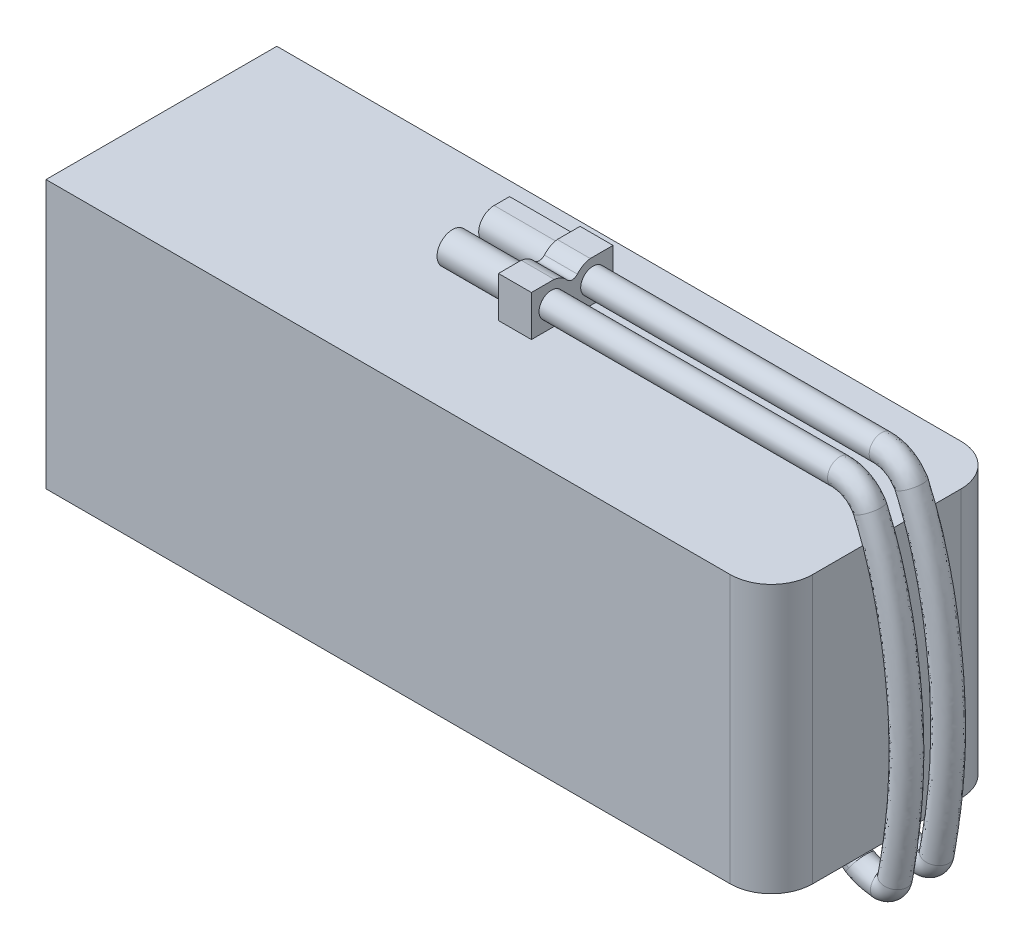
SolidWorks part; units mm, degrees
ref_plane "Front Plane" through (0, 0, 0) normal (0, 0, 1) x (1, 0, 0)
ref_plane "Top Plane" through (0, 0, 0) normal (0, 1, 0) x (1, 0, 0)
ref_plane "Right Plane" through (0, 0, 0) normal (1, 0, 0) x (0, 0, -1)
sketch "Sketch3" plane through (0, 0, 0) normal (0, 1, 0) x (1, 0, 0)
  line L0 (-88, 28) -> (-88, -28)
  line L1 (-88, -28) -> (88, -28)
  line L2 (0, 35.3062) -> (0, -46.0711) construction
  line L3 (88, -28) -> (88, 28)
  line L4 (88, 28) -> (-88, 28)
  line L5 (-17.8116, 0) -> (16.9118, 0) construction
  dimension "D2" = 176
  dimension "D3" = 56
extrude "Boss-Extrude1" add sketch "Sketch3" along normal blind 65
fillet "Fillet1" radius 10
sketch "Sketch4" plane through (0, 0, 0) normal (0, -1, 0) x (1, 0, 0)
  line L0 (88, 18) -> (88, -18) construction
  line L1 (0, 0) -> (88, 0) construction
  circle A0 centre (85, 5.05) radius 3
  dimension "D1" = 6
  dimension "D2" = 5.05
ref_plane "Plane1" through (0, 0, 5) normal (0, 0, 1) x (1, 0, 0)
sketch "Sketch6" plane through (0, 0, 5) normal (0, 0, 1) x (1, 0, 0)
  line L0 (82, 0) -> (88, 0) construction
  line L1 (82, 0) -> (88, 0)
  line L2 (85, 0) -> (85, -3.2818) construction
  line L3 (85, -3.2818) -> (92.0621, -4.2009) construction
  line L4 (88.9158, 73) -> (-1.0842, 73) construction
  line L5 (82, 0) -> (88, 0)
  line L6 (86.6904, 65) -> (86.6904, 73)
  line L8 (81.672, 77.0994) -> (11.672, 77.0994)
  line L9 (81.672, 77.0994) -> (66.8288, 77.0994)
  line L10 (88, 65) -> (78, 65)
  line L11 (78, 65) -> (78, 0)
  line L12 (78, 0) -> (88, 0)
  line L13 (88, 0) -> (88, 65)
  line L14 (88, 65) -> (78, 65)
  line L15 (78, 65) -> (78, 0)
  line L16 (78, 0) -> (88, 0)
  line L17 (88, 0) -> (88, 65)
  arc A0 (95.0362, -1.6618) -> (92.0621, -4.2009) centre (91.9872, -1.1018) cw
  arc A1 (88.9158, 73) -> (81.672, 77.0994) centre (81.8868, 69.0292) ccw
  spline S0 degree 2 poles (85, 0) (85, -3.2818) (92.0621, -4.2009) knots 0 0 0 1 1 1
  spline S1 degree 3 poles (95.0362, -1.6618) (97.1862, 10.0434) (99.3548, 32.1242) (94.3851, 60.8132) (88.9158, 73) knots 0.025921 0.025921 0.025921 0.025921 0.475299 0.975933 0.975933 0.975933 0.975933
  dimension "D1" = 90
  dimension "D3" = 3.1
  dimension "D4" = 8
  dimension "D5" = 70
  dimension "D2" = 0
sweep "Sweep1" add profiles "Sketch4" path "Sketch6"
mirror "Mirror6" about plane through (0, 0, 0) normal (0, 0, 1) of "Sweep1"
sketch "Sketch18" plane through (11.672, 0, 0) normal (-1, 0, 0) x (0, 0, 1)
  line L0 (2.05, 77.0994) -> (1.55, 77.0994) construction
  line L1 (5.05, 72.1494) -> (5.05, 82.0494) construction
  line L2 (0, -35.75) -> (0, 35.75) construction
  line L3 (-5.05, 72.1494) -> (-5.05, 82.0494) construction
  line L4 (-9.9, 72.1494) -> (9.9, 72.1494)
  line L5 (-9.9, 82.0494) -> (9.9, 82.0494) construction
  line L6 (0, 80.7455) -> (0, 79.7649) construction
  line L7 (-9.9, 72.1494) -> (-9.9, 82.0494)
  line L8 (9.9, 72.1494) -> (9.9, 82.0494)
  line L9 (9.9, 82.0494) -> (4.3728, 82.0494)
  line L10 (-9.9, 82.0494) -> (-4.3728, 82.0494)
  line L11 (-9.9, 72.1494) -> (-4.3728, 72.1494)
  line L17 (0, 72.1494) -> (0, 67.3442) construction
  line L18 (-8.8, 71.5218) -> (-8.8, 82.6771) construction
  line L19 (-8.8, 73.3494) -> (-8.8, 80.8494)
  line L21 (8.8, 80.9494) -> (4.4524, 80.9494)
  line L22 (8.8, 73.2494) -> (8.8, 80.9494)
  line L23 (5.05, 73.2494) -> (8.8, 73.2494)
  line L24 (-8.8, 80.9494) -> (-4.4524, 80.9494) construction
  line L25 (-8.8, 73.2494) -> (8.8, 73.2494) construction
  line L26 (-5.05, 80.8494) -> (-8.8, 80.8494)
  line L27 (-5.05, 73.3494) -> (-8.8, 73.3494)
  line L29 (-8.8, 73.2494) -> (-8.8, 80.9494) construction
  arc A0 (-4.3728, 82.0494) -> (-1.2482, 80.341) centre (-5.05, 77.0994) cw
  circle A1 centre (-5.05, 77.0994) radius 3 construction
  arc A2 (4.3728, 82.0494) -> (1.2482, 80.341) centre (5.05, 77.0994) ccw
  arc A3 (-1.2482, 80.341) -> (1.2482, 80.341) centre (0, 81.4053) ccw
  circle A5 centre (5.05, 77.0994) radius 3.5
  circle A12 centre (-5.05, 77.0994) radius 3.75
  circle A13 centre (-5.05, 77.0994) radius 3
  circle A14 centre (-5.05, 77.0994) radius 3
  circle A15 centre (5.05, 77.0994) radius 3
  circle A16 centre (5.05, 77.0994) radius 3
  arc A19 (4.4524, 80.9494) -> (2.0853, 79.6273) centre (5.05, 77.0994) ccw
  arc A20 (-4.4524, 80.9494) -> (-2.0853, 79.6273) centre (-5.05, 77.0994) cw construction
  arc A21 (-2.0853, 79.6273) -> (2.0853, 79.6273) centre (0, 81.4053) ccw construction
  point P7 (5.05, 77.0994)
  point P18 (0, 72.1494)
  point P37 (-8.8, 77.0994)
  point P44 (-5.05, 74.0994)
  point P46 (-0.5539, 74.0994)
  dimension "D2" = 0.6772
  dimension "D3" = 1.6404
  dimension "D5" = 1.1
  dimension "D6" = 7
  dimension "D10" = 7.5
  dimension "D1" = 9.9
  dimension "D4" = 19.8
  dimension "D8" = 0
  dimension "D9" = 0
extrude "Boss-Extrude3" add sketch "Sketch18" along normal blind 8 separate body
sketch "Sketch24" plane through (3.672, 0, 0) normal (-1, 0, 0) x (0, 0, 1)
  line L0 (-5.05, 73.3494) -> (-8.8, 73.3494) construction
  line L1 (-5.05, 73.3494) -> (-8.8, 73.3494)
  line L2 (-5.05, 80.8494) -> (-8.8, 80.8494) construction
  line L3 (-8.8, 73.3494) -> (-8.8, 80.8494) construction
  line L4 (-5.05, 80.8494) -> (-8.8, 80.8494)
  line L5 (-4.3728, 82.0494) -> (-9.9, 82.0494)
  line L6 (-9.9, 82.0494) -> (-9.9, 72.1494)
  line L7 (-9.9, 72.1494) -> (9.9, 72.1494)
  line L8 (9.9, 72.1494) -> (9.9, 82.0494)
  line L9 (9.9, 82.0494) -> (4.3728, 82.0494)
  line L10 (-4.3728, 82.0494) -> (-9.9, 82.0494)
  line L11 (-9.9, 82.0494) -> (-9.9, 72.1494)
  line L12 (-9.9, 72.1494) -> (9.9, 72.1494)
  line L13 (9.9, 72.1494) -> (9.9, 82.0494)
  line L14 (9.9, 82.0494) -> (4.3728, 82.0494)
  line L15 (-8.8, 73.3494) -> (-8.8, 80.8494)
  circle A0 centre (-5.05, 77.0994) radius 3.75 construction
  circle A1 centre (-5.05, 77.0994) radius 3.75
  arc A3 (-1.2482, 80.341) -> (1.2482, 80.341) centre (0, 81.4053) ccw
  arc A4 (-1.2482, 80.341) -> (-4.3728, 82.0494) centre (-5.05, 77.0994) ccw
  arc A5 (4.3728, 82.0494) -> (1.2482, 80.341) centre (5.05, 77.0994) ccw
  arc A6 (-1.2482, 80.341) -> (1.2482, 80.341) centre (0, 81.4053) ccw
  arc A7 (-1.2482, 80.341) -> (-4.3728, 82.0494) centre (-5.05, 77.0994) ccw
  arc A8 (4.3728, 82.0494) -> (1.2482, 80.341) centre (5.05, 77.0994) ccw
  circle A13 centre (-5.05, 77.0994) radius 3.25
  circle A14 centre (5.05, 77.0994) radius 3.25
  circle A15 centre (5.05, 77.0994) radius 3.75
  dimension "D2" = 6.5
  dimension "D3" = 6.5
  dimension "D4" = 7.5
  dimension "D1" = 0
extrude "Boss-Extrude5" add sketch "Sketch24" along normal blind 16 separate body contours A1 A13 | A1 L4 L15 | A1 L15 L1 | A15 A14
